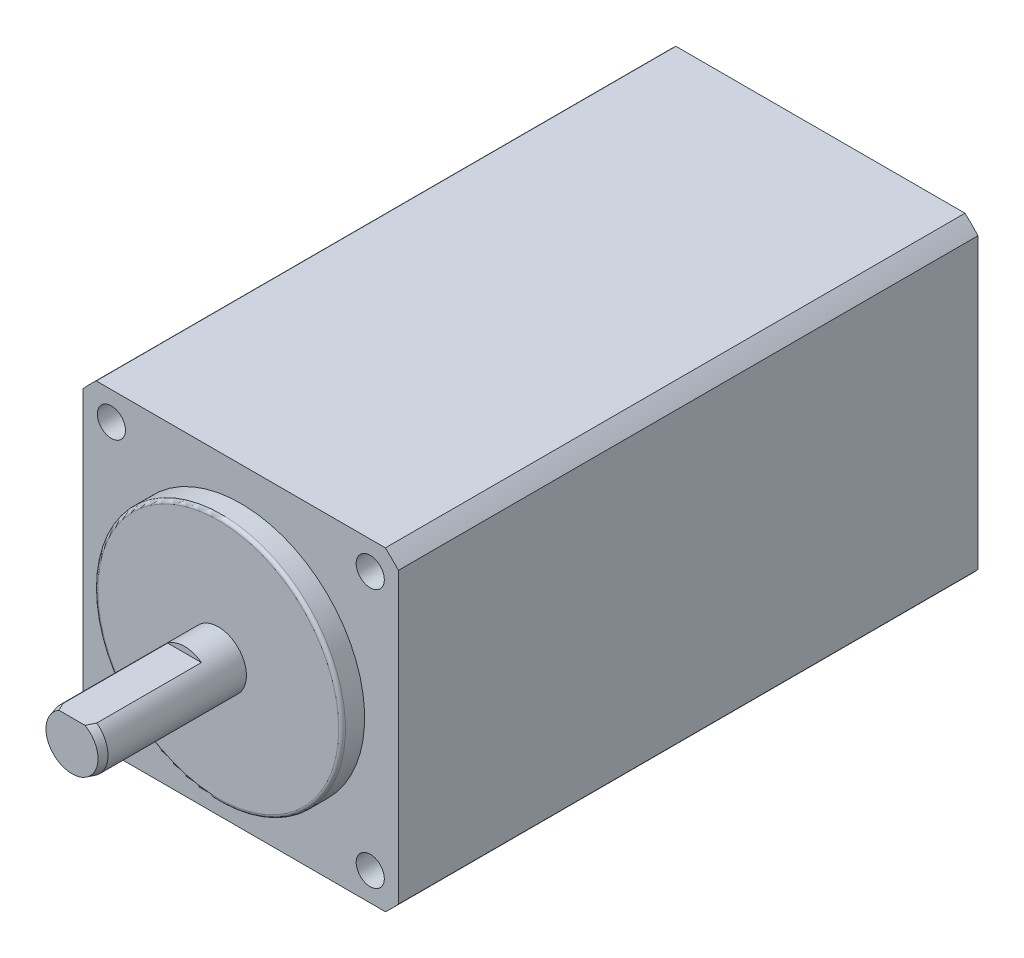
SolidWorks part; units mm, degrees
ref_plane "正面" through (0, 0, 0) normal (0, 0, 1) x (1, 0, 0)
ref_plane "平面" through (0, 0, 0) normal (0, 1, 0) x (1, 0, 0)
ref_plane "右側面" through (0, 0, 0) normal (1, 0, 0) x (0, 0, -1)
sketch "Sketch1" plane through (0, 0, 0) normal (0, 0, 1) x (1, 0, 0)
  circle A0 centre (0, 0) radius 2.5
  dimension "D1" = 5
extrude "Extrude1" add sketch "Sketch1" along normal blind 15
sketch "Sketch2" plane through (0, 0, 0) normal (0, 0, -1) x (-1, 0, 0)
  circle A0 centre (0, 0) radius 11
  dimension "D1" = 22
extrude "Extrude2" add sketch "Sketch2" against normal blind 2
sketch "Sketch3" plane through (0, 0, 0) normal (0, 0, -1) x (-1, 0, 0)
  line L1 (14, -14) -> (-14, -14)
  line L2 (14, -14) -> (14, 14)
  line L3 (14, 14) -> (-14, 14)
  line L4 (-14, -14) -> (-14, 14)
  line L5 (14, -14) -> (-14, 14) construction
  line L6 (14, 14) -> (-14, -14) construction
  circle A0 centre (0, 0) radius 19
  point P0 (0, 0)
  dimension "D3" = 38
  dimension "D1" = 28
  dimension "D2" = 28
extrude "Extrude3" add sketch "Sketch3" along normal blind 51.5 separate body contours L2 A0 L3 L4 L1 M1 | M1
sketch "Sketch4" plane through (0, -14, 0) normal (0, -1, 0) x (1, 0, 0)
  line L0 (-12.8452, -51.5) -> (12.8452, -51.5) construction
  line L1 (-7.6, -51.5) -> (7.6, -51.5)
  line L2 (-7.6, -51.5) -> (-7.6, -42)
  line L3 (-7.6, -42) -> (7.6, -42)
  line L4 (7.6, -51.5) -> (7.6, -42)
  dimension "D1" = 9.5
  dimension "D2" = 15.2
  dimension "D3" = 7.6
extrude "Extrude4" add sketch "Sketch4" along normal blind 5
sketch "Sketch5" plane through (0, 0, 15) normal (0, 0, 1) x (1, 0, 0)
  line L1 (-2.5379, 4.1995) -> (2.6225, 4.1995)
  line L2 (-2.5379, 4.1995) -> (-2.5379, 2)
  line L3 (-2.5379, 2) -> (2.6225, 2)
  line L4 (2.6225, 4.1995) -> (2.6225, 2)
  dimension "D1" = 2
extrude "Extrude5" cut sketch "Sketch5" against normal blind 10
chamfer "Chamfer1" distance 0.7 angle 15 1 edges at (0, -2.5, 15)
sketch "Sketch6" plane through (0, 0, 0) normal (0, 0, 1) x (1, 0, 0)
  line L1 (11.5, -11.5) -> (-11.5, -11.5) construction
  line L2 (11.5, -11.5) -> (11.5, 11.5) construction
  line L3 (11.5, 11.5) -> (-11.5, 11.5) construction
  line L4 (-11.5, -11.5) -> (-11.5, 11.5) construction
  line L5 (11.5, -11.5) -> (-11.5, 11.5) construction
  line L6 (11.5, 11.5) -> (-11.5, -11.5) construction
  circle A0 centre (-11.5, 11.5) radius 1.25
  circle A1 centre (11.5, 11.5) radius 1.25
  circle A2 centre (-11.5, -11.5) radius 1.25
  circle A3 centre (11.5, -11.5) radius 1.25
  point P0 (0, 0)
  dimension "D3" = 2.5
  dimension "D1" = 23
  dimension "D2" = 23
extrude "Extrude6" cut sketch "Sketch6" against normal blind 4.5
fillet "Fillet2" radius 0.3 1 edges at (-11, 0, 2)
